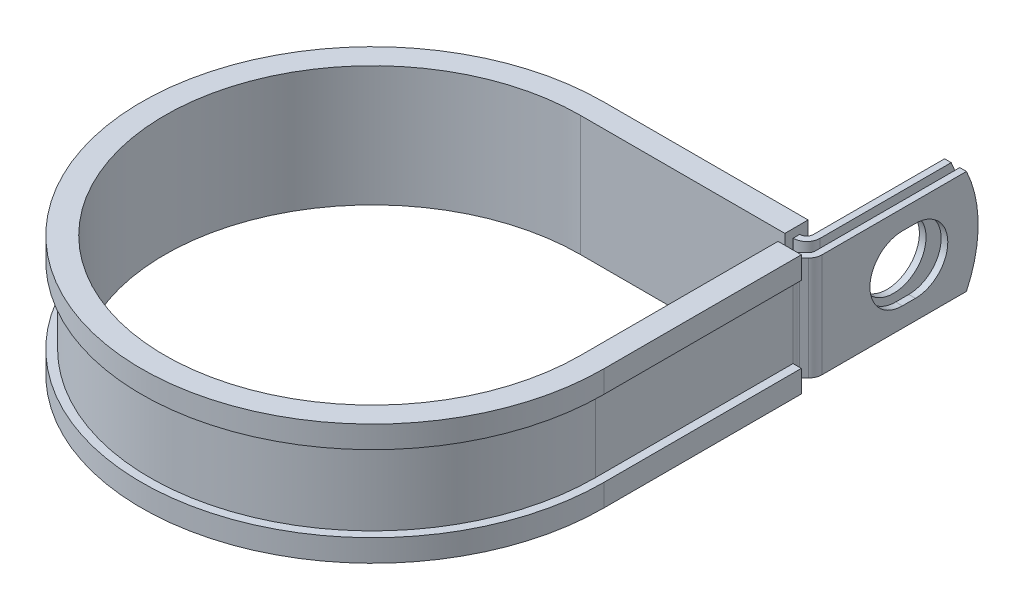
SolidWorks part; units mm, degrees
ref_plane "Front Plane" through (0, 0, 0) normal (0, 0, 1) x (1, 0, 0)
ref_plane "Top Plane" through (0, 0, 0) normal (0, 1, 0) x (1, 0, 0)
ref_plane "Right Plane" through (0, 0, 0) normal (1, 0, 0) x (0, 0, -1)
sketch "Sketch1" plane through (0, 0, 0) normal (0, 1, 0) x (1, 0, 0)
  line L0 (0, 39.624) -> (37.5083, 39.624)
  line L1 (39.624, 0) -> (39.624, 36.2115)
  line L2 (39.9467, 68.2498) -> (39.9467, 42.0624)
  line L3 (40.3382, 37.9357) -> (41.1644, 38.7619)
  line L5 (41.5215, 39.624) -> (41.5215, 68.2498)
  arc A0 (0, 39.624) -> (39.624, 0) centre (0, 0) ccw
  arc A1 (40.3382, 37.9357) -> (39.624, 36.2115) centre (42.0624, 36.2115) ccw
  arc A2 (41.1644, 38.7619) -> (41.5215, 39.624) centre (40.3023, 39.624) ccw
  arc A3 (37.5083, 39.624) -> (39.9467, 42.0624) centre (37.5083, 42.0624) ccw
extrude "Extrude-Thin1" add sketch "Sketch1" along normal mid plane 19.05 thin
sketch "Sketch2" plane through (38.7275, 0, 0) normal (-1, 0, 0) x (0, 0, 1)
  line L0 (-68.2498, 9.525) -> (-68.2498, -9.525) construction
  line L1 (0, 9.525) -> (0, -9.525) construction
  circle A0 centre (-55.5498, 0) radius 5.9436
  point P2 (-68.2498, 0)
extrude "Cut-Extrude1" cut sketch "Sketch2" against normal up to surface (1.2192 mm away)
sketch "Sketch3" plane through (42.7407, 0, 0) normal (1, 0, 0) x (0, 0, -1)
  line L0 (54.356, 0) -> (56.7436, 0) construction
  line L1 (54.356, 5.9436) -> (56.7436, 5.9436)
  line L2 (54.356, -5.9436) -> (56.7436, -5.9436)
  line L3 (68.2498, 9.525) -> (68.2498, -9.525) construction
  arc A0 (54.356, 5.9436) -> (54.356, -5.9436) centre (54.356, 0) ccw
  arc A1 (56.7436, -5.9436) -> (56.7436, 5.9436) centre (56.7436, 0) ccw
  point P3 (55.5498, 0)
  point P8 (68.2498, 0)
  point P11 (48.4124, 0)
  point P12 (62.6872, 0)
extrude "Cut-Extrude2" cut sketch "Sketch3" against normal up to surface (1.2192 mm away)
sketch "Sketch4" plane through (38.7275, 0, 0) normal (-1, 0, 0) x (0, 0, 1)
  line L0 (-68.2498, 9.525) -> (-68.2498, -9.525)
  line L1 (-68.2498, 9.525) -> (-66.1053, 9.525)
  line L2 (-68.2498, 9.525) -> (-42.0624, 9.525) construction
  line L3 (-68.2498, -9.525) -> (-66.1053, -9.525)
  line L4 (-68.2498, -9.525) -> (-42.0624, -9.525) construction
  arc A0 (-66.1053, 9.525) -> (-66.1053, -9.525) centre (-46.0248, 0) ccw
extrude "Cut-Extrude3" cut sketch "Sketch4" against normal through all contours A0 M4 M5 | A0 L0 M2
ref_plane "Plane1" through (0, 0, -36.2115) normal (0, 0, -1) x (-1, 0, 0)
ref_plane "Plane2" through (37.4575, 0, 0) normal (-1, 0, 0) x (0, 0, 1)
sketch "Sketch5" plane through (0, 0, -36.2115) normal (0, 0, -1) x (-1, 0, 0)
  line L0 (-40.8432, 9.525) -> (-39.624, 9.525)
  line L1 (-40.8432, 9.525) -> (-40.8432, -9.525) construction
  line L3 (-39.624, 9.525) -> (-39.624, -9.525)
  line L4 (-39.624, -9.525) -> (-40.8432, -9.525)
  line L5 (-40.8432, -9.525) -> (-40.8432, -6.985)
  line L6 (-40.8432, 9.525) -> (-40.8432, 6.985)
  line L7 (-42.3672, 11.049) -> (-42.3672, 6.985)
  line L8 (-42.3672, 11.049) -> (-38.1, 11.049)
  line L9 (-38.1, 11.049) -> (-38.1, -11.049)
  line L10 (-38.1, -11.049) -> (-42.3672, -11.049)
  line L11 (-42.3672, -11.049) -> (-42.3672, -6.985)
  line L12 (-42.3672, 6.985) -> (-40.8432, 6.985)
  line L13 (-40.8432, -6.985) -> (-42.3672, -6.985)
sketch "Sketch6" plane through (0, 9.525, 0) normal (0, 1, 0) x (1, 0, 0)
  line L0 (38.1, 0) -> (38.1, 36.2115)
  line L1 (38.1, 36.2115) -> (42.3672, 36.2115) construction
  line L2 (37.4575, 6.9878) -> (37.4575, -6.9878) construction
  line L5 (0, 38.1) -> (37.4575, 38.1)
  arc A0 (0, 38.1) -> (38.1, 0) centre (0, 0) ccw
sweep "Sweep1" add profiles "Sketch5" path "Sketch6"
equation "\"D4@Sketch5\" = \"D1@Extrude-Thin1\""
equation "\"D5@Sketch5\" = \"D5@Extrude-Thin1\""
equation "\"D1@Sketch3\" = \"D2@Sketch2\""
equation "\"D7@Sketch1\" = \"D3@Sketch2\" + \"D1@Sketch3\""
equation "\"D1@Sketch1\" = \"D1@Sketch6\" + 2 * \"D3@Sketch5\""
equation "\"D1@Sketch4\" = ( \"D1@Extrude-Thin1\" + .125 ) * 2"
equation "\"D9@Sketch1\"= \"D5@Extrude-Thin1\""
equation "\"D8@Sketch1\"= 2 * \"D5@Extrude-Thin1\""
equation "\"D2@Sketch1\" = 2 * \"D5@Extrude-Thin1\""
equation "\"D2@Sketch3\" = \"D1@Sketch2\""
